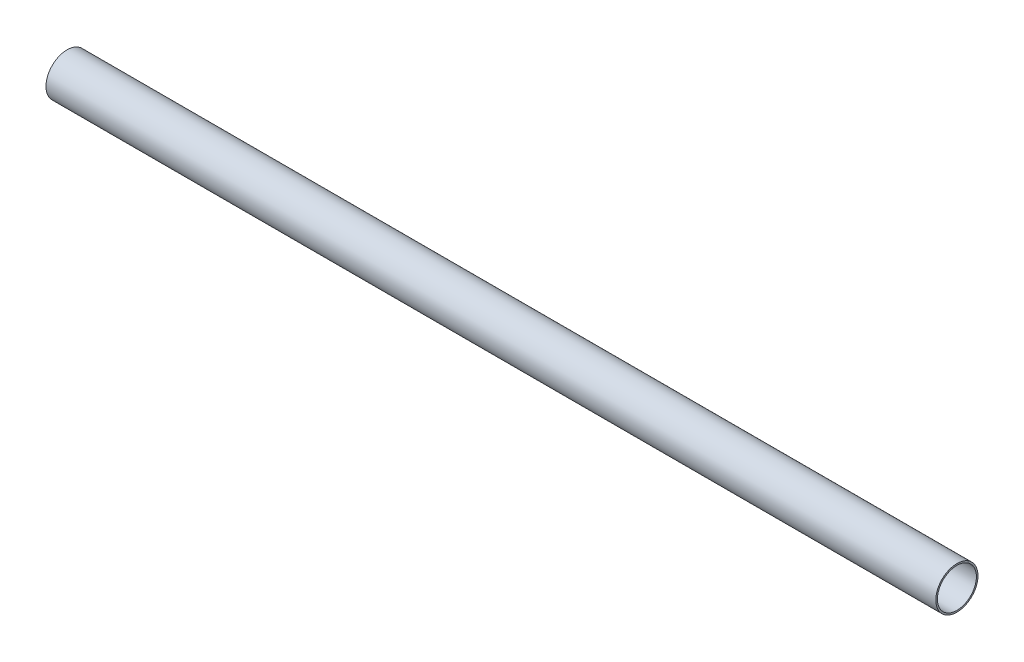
SolidWorks part; units mm, degrees
ref_plane "Front Plane" through (0, 0, 0) normal (0, 0, 1) x (1, 0, 0)
ref_plane "Top Plane" through (0, 0, 0) normal (0, 1, 0) x (1, 0, 0)
ref_plane "Right Plane" through (0, 0, 0) normal (1, 0, 0) x (0, 0, -1)
sketch "Sketch1" plane through (0, 0, 0) normal (1, 0, 0) x (0, 0, -1)
  circle A0 centre (0, 0) radius 21.082
  circle A1 centre (0, 0) radius 19.4691
  dimension "D1" = 42.164
  dimension "D2" = 1.6129
extrude "Extrude1" add sketch "Sketch1" along normal mid plane 889
